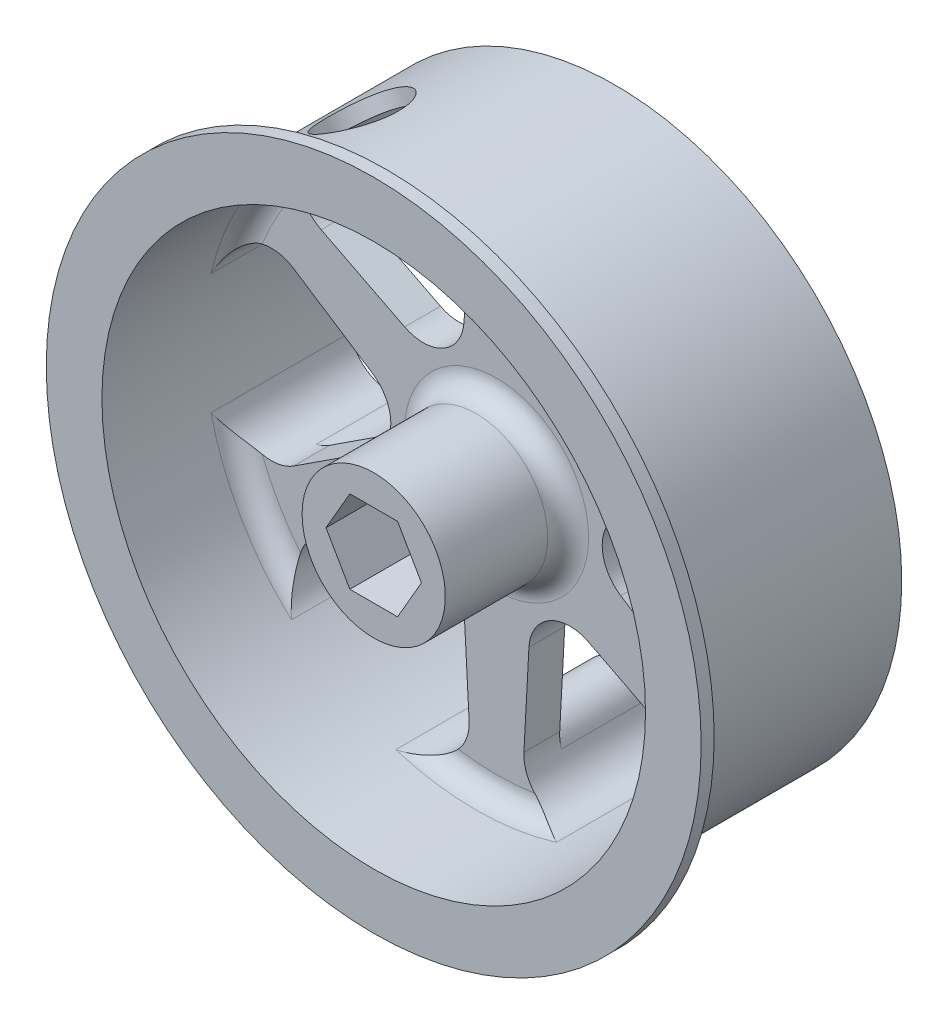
SolidWorks part; units mm, degrees
ref_plane "Front Plane" through (0, 0, 0) normal (0, 0, 1) x (1, 0, 0)
ref_plane "Top Plane" through (0, 0, 0) normal (0, 1, 0) x (1, 0, 0)
ref_plane "Right Plane" through (0, 0, 0) normal (1, 0, 0) x (0, 0, -1)
imported_body "Imported1"
sketch "Sketch1" plane through (0, 0, 21.9075) normal (0, 0, 1) x (1, 0, 0)
  circle A0 centre (0, 0) radius 11.1125 construction
  circle A1 centre (0, 0) radius 11.1125
extrude "Cut-Extrude1" cut sketch "Sketch1" against normal up to surface (6.35 mm away)
